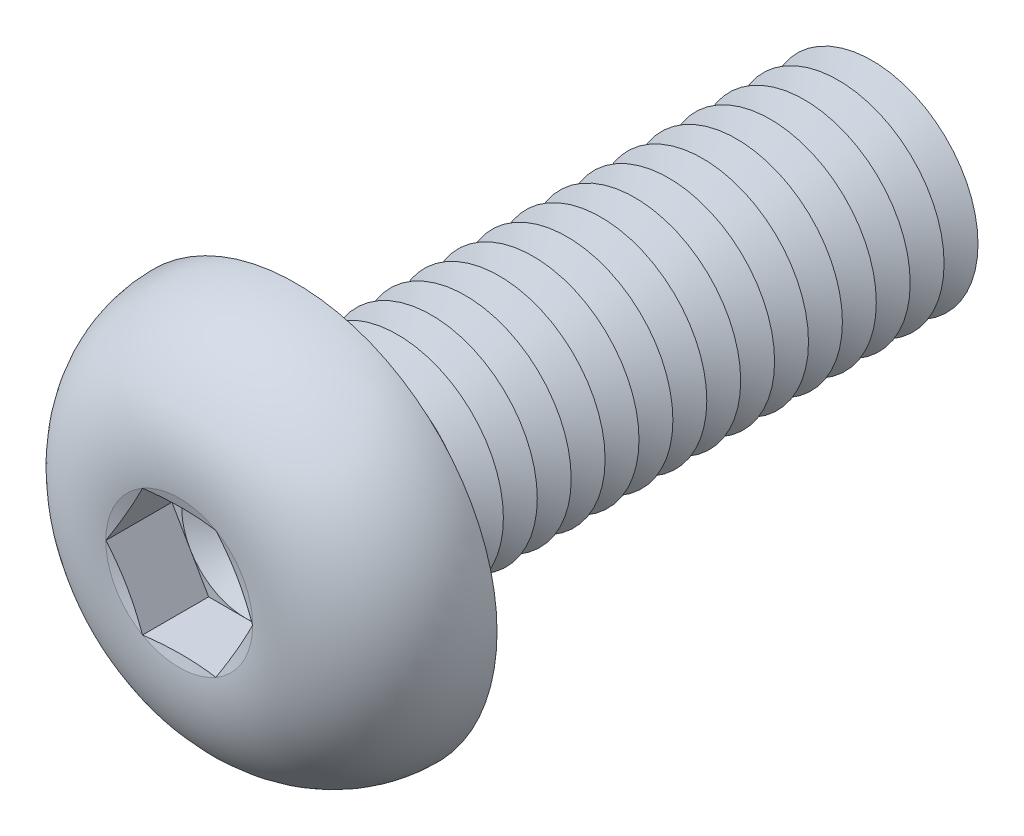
SolidWorks part; units mm, degrees
ref_plane "Front Plane" through (0, 0, 0) normal (0, 0, 1) x (1, 0, 0)
ref_plane "Top Plane" through (0, 0, 0) normal (0, 1, 0) x (1, 0, 0)
ref_plane "Right Plane" through (0, 0, 0) normal (1, 0, 0) x (0, 0, -1)
sketch "Sketch1" plane through (0, 0, 0) normal (1, 0, 0) x (0, 0, -1)
  line L0 (0, 2.5) -> (0, 4.75)
  line L3 (0, 2.5) -> (14, 2.5)
  line L4 (14, 2.5) -> (14, 0)
  line L5 (14, 0) -> (-2.75, 0) construction
  line L6 (-2.75, 0) -> (14, 0)
  line L7 (-2.75, 1.732) -> (-2.75, 0.866) construction
  line L8 (-2.75, 0.866) -> (-2.75, 0)
  line L9 (-2.75, 1.732) -> (-2.5179, 0.866)
  line L10 (-2.5179, 0.866) -> (-2.75, 0.866)
  line L11 (14, 0) -> (22.7481, 0) construction
  line L12 (0, 4.75) -> (-2.75, 4.75) construction
  arc A1 (0, 4.75) -> (-2.75, 1.732) centre (0, 1.9881) ccw
  point P8 (14, 1.25)
  dimension "D1" = 9.5
  dimension "D2" = 5
  dimension "D3" = 2.75
  dimension "D4" = 3.4641
  dimension "D5" = 14
  dimension "D6" = 15
revolve "Revolve1" add sketch "Sketch1" angle 360 about L5
fillet "Fillet1" radius 0.4 1 edges at (-2.5, 0, 0)
sketch "Sketch2" plane through (0, 0, 0) normal (1, 0, 0) x (0, 0, -1)
  line L0 (13.6, 2.5) -> (14.4, 2.5)
  line L1 (14, 2.5) -> (0.4, 2.5) construction
  line L2 (14.4, 2.5) -> (14, 1.8072)
  line L3 (14, -2.5) -> (14, 2.5) construction
  line L4 (14, 1.8072) -> (13.6, 2.5)
  dimension "D1" = 0.8
revolve "Cut-Revolve1" cut sketch "Sketch2" angle 360 about axis through (0, 0, -14) along (0, 0, -1)
pattern_linear "LPattern1" count 17 spacing 0.8 along (0, 0, 1) of "Cut-Revolve1"
sketch "Sketch3" plane through (0, 0, 2.75) normal (0, 0, 1) x (1, 0, 0)
  line L7 (0.866, 1.5) -> (-0.866, 1.5)
  line L8 (-0.866, 1.5) -> (-1.7321, 0)
  line L9 (-1.7321, 0) -> (-0.866, -1.5)
  line L10 (-0.866, -1.5) -> (0.866, -1.5)
  line L11 (0.866, -1.5) -> (1.7321, 0)
  line L12 (1.7321, 0) -> (0.866, 1.5)
  circle A0 centre (0, 0) radius 1.5 construction
  circle A3 centre (0, 0) radius 1.732 construction
extrude "Cut-Extrude1" cut sketch "Sketch3" against normal blind 1.56
sketch "Sketch4" plane through (0, 0, 1.19) normal (0, 0, 1) x (1, 0, 0)
  line L1 (0.866, 1.5) -> (-0.866, 1.5) construction
  circle A0 centre (0, 0) radius 1.5
extrude "Cut-Extrude2" cut sketch "Sketch4" against normal through all draft 60
